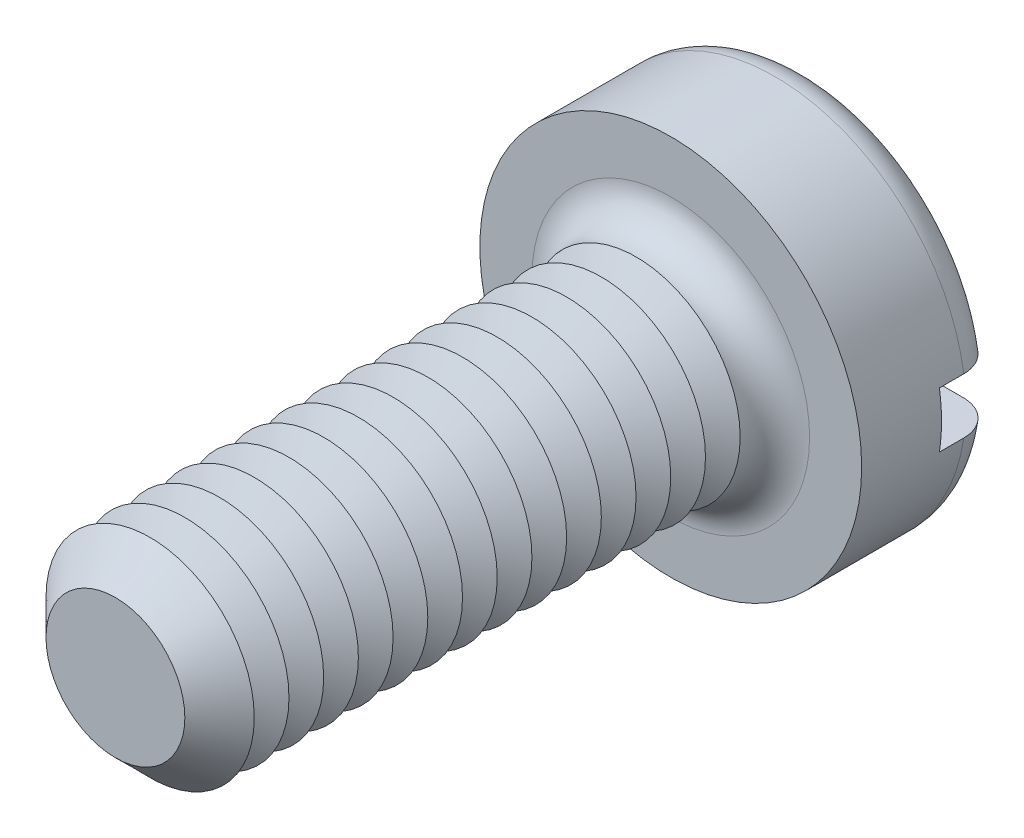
SolidWorks part; units mm, degrees
ref_plane "Front Plane" through (0, 0, 0) normal (0, 0, 1) x (1, 0, 0)
ref_plane "Top Plane" through (0, 0, 0) normal (0, 1, 0) x (1, 0, 0)
ref_plane "Right Plane" through (0, 0, 0) normal (1, 0, 0) x (0, 0, -1)
sketch "Sketch3" plane through (0, 0, 0) normal (0, 0, 1) x (1, 0, 0)
  circle A0 centre (0, 0) radius 2.75
  dimension "D1" = 5.5
extrude "Boss-Extrude2" add sketch "Sketch3" against normal blind 2
sketch "Sketch4" plane through (0, 0, 0) normal (0, 0, 1) x (1, 0, 0)
  circle A0 centre (0, 0) radius 1.5
  dimension "D1" = 3
extrude "Boss-Extrude3" add sketch "Sketch4" along normal blind 8
fillet "Fillet1" radius 0.5 2 edges at (2.75, 0, -2) (1.5, 0, 0)
chamfer "Chamfer1" distance 0.5 angle 45 1 edges at (1.5, 0, 8)
sketch "Sketch5" plane through (0, 0, 0) normal (1, 0, 0) x (0, 0, -1)
  line L0 (1.6944, 0) -> (-7.6738, 0) construction
sketch "Sketch6" plane through (0, 0, 0) normal (1, 0, 0) x (0, 0, -1)
  line L0 (-0.5, 1.5) -> (-0.75, 1.067)
  line L1 (-0.75, 1.067) -> (-1, 1.5)
  line L2 (-0.5, 1.5) -> (-7.5, 1.5) construction
  line L3 (-1, 1.5) -> (-0.5, 1.5)
  dimension "D1" = 0.5
revolve "Cut-Revolve1" cut sketch "Sketch6" angle 360 about L0
pattern_linear "LPattern1" count 14 spacing 0.5 along (0, 0, 1) of "Cut-Revolve1"
sketch "Sketch8" plane through (0, 0, -2) normal (0, 0, -1) x (-1, 0, 0)
  line L1 (2.75, -0.4) -> (-2.75, -0.4)
  line L2 (2.75, -0.4) -> (2.75, 0.4)
  line L3 (2.75, 0.4) -> (-2.75, 0.4)
  line L4 (-2.75, -0.4) -> (-2.75, 0.4)
  line L5 (2.75, -0.4) -> (-2.75, 0.4) construction
  line L6 (2.75, 0.4) -> (-2.75, -0.4) construction
  point P0 (0, 0)
  dimension "D1" = 5.5
  dimension "D2" = 0.8
extrude "Cut-Extrude1" cut sketch "Sketch8" against normal blind 0.85
